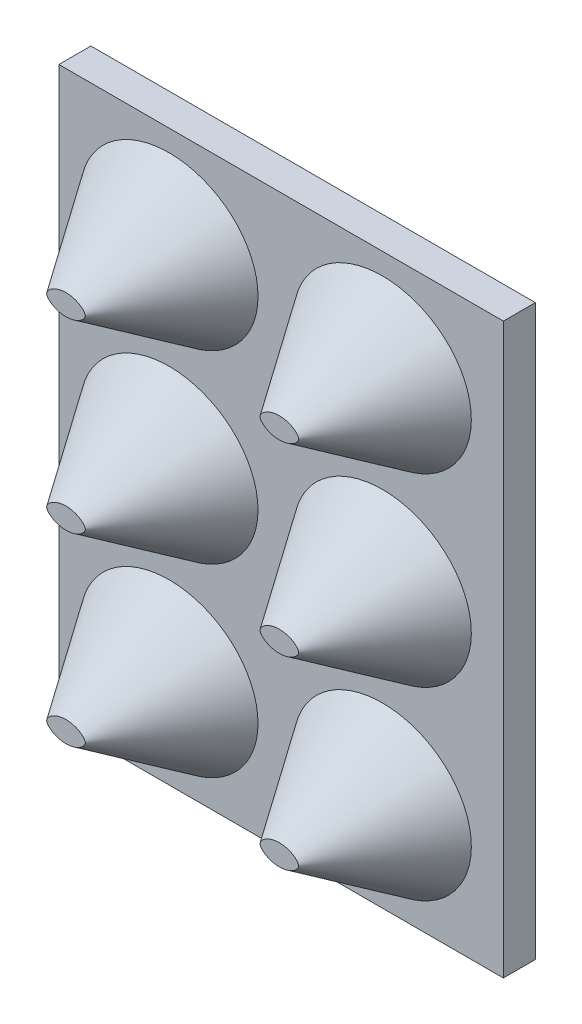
SolidWorks part; units mm, degrees
ref_plane "Front Plane" through (0, 0, 0) normal (0, 0, 1) x (1, 0, 0)
ref_plane "Top Plane" through (0, 0, 0) normal (0, 1, 0) x (1, 0, 0)
ref_plane "Right Plane" through (0, 0, 0) normal (1, 0, 0) x (0, 0, -1)
sketch "Sketch1" plane through (0, 0, 0) normal (0, 0, 1) x (1, 0, 0)
  line L1 (0, 0) -> (-125, 0)
  line L2 (0, 0) -> (0, 160)
  line L3 (0, 160) -> (-125, 160)
  line L4 (-125, 0) -> (-125, 160)
  dimension "D1" = 160
  dimension "D2" = 125
  dimension "D3" = 160
extrude "Boss-Extrude1" add sketch "Sketch1" along normal blind 9
sketch "Sketch2" plane through (0, 0, 9) normal (0, 0, 1) x (1, 0, 0)
  line L0 (-125, 0) -> (0, 0) construction
  line L1 (-125, 160) -> (-125, 0) construction
  ellipse E0 centre (-94, 27.5) end of major axis (-119, 27.5) minor radius 22.5
  dimension "D1" = 50
  dimension "D2" = 45
  dimension "D3" = 5
  dimension "D4" = 6
extrude "Boss-Extrude2" add sketch "Sketch2" along normal blind 29 draft 34
pattern_linear "LPattern1" count 3 spacing 52 along (0, -1, 0) count 2 spacing 60 along (1, 0, 0) of "Boss-Extrude2"
